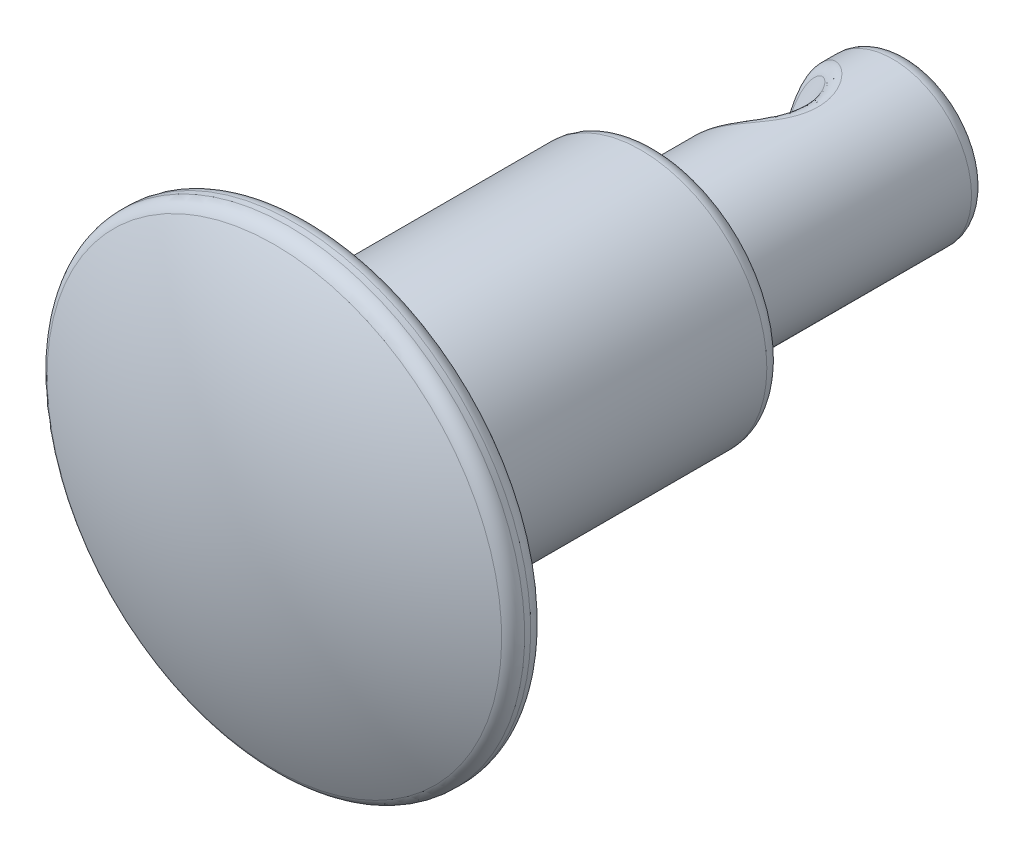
SolidWorks part; units mm, degrees
ref_plane "Спереди" through (0, 0, 0) normal (0, 0, 1) x (1, 0, 0)
ref_plane "Сверху" through (0, 0, 0) normal (0, 1, 0) x (1, 0, 0)
ref_plane "Справа" through (0, 0, 0) normal (1, 0, 0) x (0, 0, -1)
sketch "Эскиз1" plane through (0, 0, 0) normal (1, 0, 0) x (0, 0, -1)
  line L0 (-10.9015, 0) -> (10.9015, 0)
  line L1 (10.9015, 0) -> (10.9015, 2.5)
  line L2 (10.9015, 2.5) -> (2.9015, 2.5)
  line L3 (2.9015, 2.5) -> (2.9015, 4)
  line L4 (2.9015, 4) -> (-8.0985, 4)
  line L5 (-8.0985, 4) -> (-8.0985, 7.5)
  line L6 (-8.0985, 7.5) -> (-9.0985, 7.5)
  arc A0 (-9.0985, 7.5) -> (-10.9015, 0) centre (5.5985, 0) ccw
  dimension "D7" = 33
  dimension "D1" = 11
  dimension "D2" = 8
  dimension "D3" = 2.5
  dimension "D4" = 4
  dimension "D5" = 7.5
  dimension "D6" = 1
revolve "Повернуть1" add sketch "Эскиз1" angle 360 about L0
fillet "Скругление1" radius 0.5 6 edges at (0, -2.5, -10.9015) (0, -2.5, -2.9015) (0, -4, -2.9015) (0, -4, 8.0985) (0, -7.5, 9.0985) (0, -7.5, 8.0985)
extrude "Вырез-Вытянуть1" cut sketch "Эскиз2" along normal through all
sketch "Эскиз2" plane through (22.5155, 45.7619, -7.9015) normal (-0.5005, -0.8657, 0) x (0.8657, -0.5005, 0)
  line L4 (0, 0) -> (-149.3284, 0) construction
  line L6 (0, 3) -> (-149.3317, 3) construction
  circle A0 centre (0, 0) radius 2
  circle A1 centre (0, 3) radius 2 construction
fillet "Скругление2" radius 0.5 1 edges at (-1.8368, 1.6959, -6.1536)
